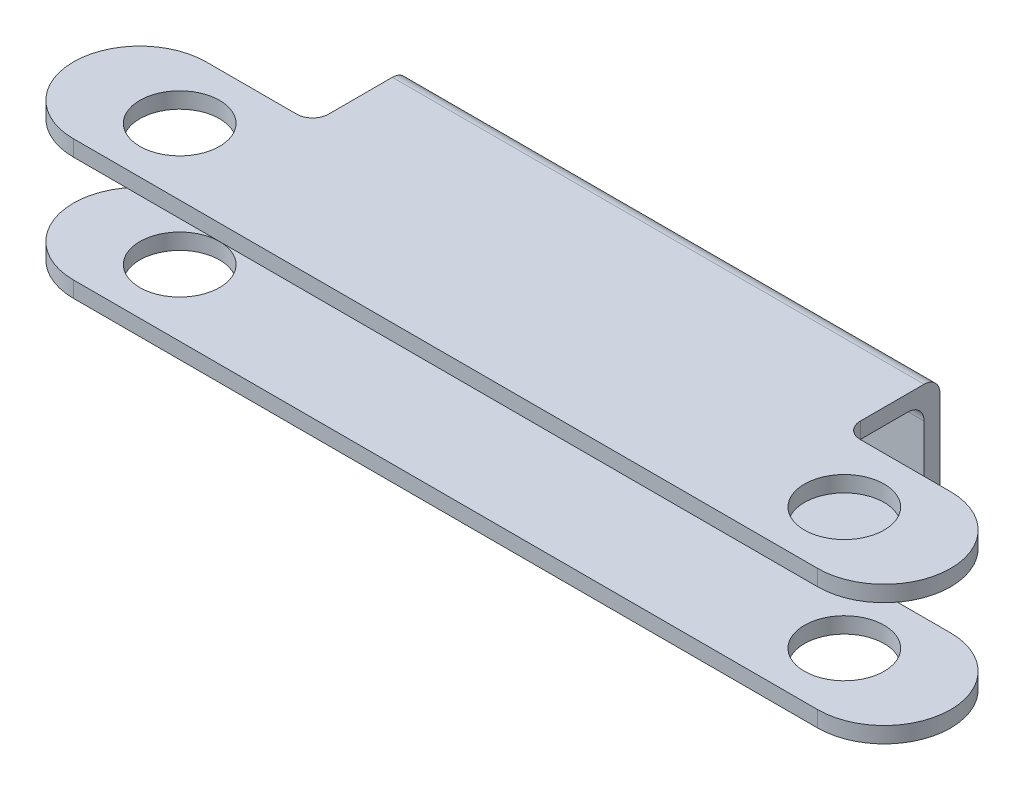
SolidWorks part; units mm, degrees
ref_plane "Vorne" through (0, 0, 0) normal (0, 0, 1) x (1, 0, 0)
ref_plane "Oben" through (0, 0, 0) normal (0, 1, 0) x (1, 0, 0)
ref_plane "Rechts" through (0, 0, 0) normal (1, 0, 0) x (0, 0, -1)
sketch "Skizze1" plane through (0, 0, 0) normal (0, 1, 0) x (1, 0, 0)
  line L0 (-140, 25) -> (-106, 25)
  line L1 (-100, 31) -> (-100, 55)
  line L2 (-100, 55) -> (100, 55)
  line L3 (100, 55) -> (100, 31)
  line L4 (106, 25) -> (140, 25)
  line L5 (-140, -25) -> (140, -25)
  line L6 (0, 0) -> (0, 25) construction
  circle A0 centre (-125, 0) radius 15
  circle A1 centre (125, 0) radius 15
  arc A2 (-106, 25) -> (-100, 31) centre (-106, 31) ccw
  arc A3 (140, -25) -> (140, 25) centre (140, 0) ccw
  arc A4 (-140, 25) -> (-140, -25) centre (-140, 0) ccw
  arc A5 (100, 31) -> (106, 25) centre (106, 31) ccw
  point P17 (-100, 25)
  point P20 (100, 25)
  dimension "D1" = 250
  dimension "D3" = 200
  dimension "D8" = 30
  dimension "D9" = 30
  dimension "D10" = 25
  dimension "D11" = 25
  dimension "D13" = 6
  dimension "D2" = 34
  dimension "D4" = 15
  dimension "D5" = 15
  dimension "D6" = 34
  dimension "D12" = 30
extrude "Linear austragen1" add sketch "Skizze1" along normal blind 6
ref_plane "Ebene3" through (0, 6, 0) normal (0, 1, 0) x (-1, 0, 0)
sketch "Skizze4" plane through (0, 6, 0) normal (0, 1, 0) x (-1, 0, 0)
  line L1 (100, -55) -> (-100, -55)
  line L2 (100, -55) -> (100, -61)
  line L3 (100, -61) -> (-100, -61)
  line L4 (-100, -55) -> (-100, -61)
  dimension "D1" = 6
extrude "Linear austragen2" add sketch "Skizze4" against normal blind 55
fillet "Verrundung1" radius 6 1 edges at (0, 6, -61)
fillet "Verrundung2" radius 6 1 edges
ref_plane "Ebene4" [suppressed] through (0, -20, 0) normal (0, -1, 0) x (1, 0, 0)
mirror "Spiegeln4" about plane through (0, -20, 0) normal (0, -1, 0) of "Linear austragen1"
